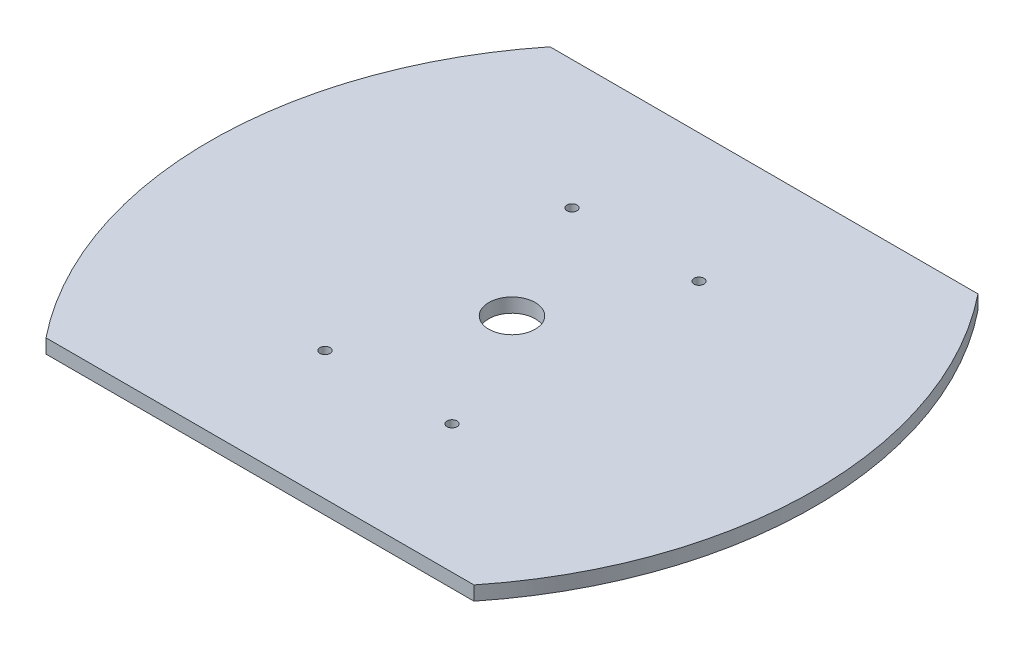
SolidWorks part; units mm, degrees
ref_plane "Front Plane" through (0, 0, 0) normal (0, 0, 1) x (1, 0, 0)
ref_plane "Top Plane" through (0, 0, 0) normal (0, 1, 0) x (1, 0, 0)
ref_plane "Right Plane" through (0, 0, 0) normal (1, 0, 0) x (0, 0, -1)
sketch "Sketch1" plane through (0, 0, 0) normal (0, 1, 0) x (1, 0, 0)
  line L1 (-106.1249, 125) -> (106.1249, 125)
  line L2 (-106.1249, 125) -> (-106.1249, -125) construction
  line L3 (-106.1249, -125) -> (106.1249, -125)
  line L4 (106.1249, 125) -> (106.1249, -125) construction
  line L5 (-106.1249, 125) -> (106.1249, -125) construction
  line L6 (-106.1249, -125) -> (106.1249, 125) construction
  arc A0 (-106.1249, -125) -> (-106.1249, 125) centre (50, 0) cw
  arc A1 (106.1249, 125) -> (106.1249, -125) centre (-50, 0) cw
  point P0 (0, 0)
  point P8 (-150, 0)
  point P9 (150, 0)
  dimension "D3" = 200
  dimension "D1" = 300
  dimension "D2" = 250
extrude "Boss-Extrude1" add sketch "Sketch1" along normal mid plane 7
sketch "Sketch2" plane through (0, 0, 0) normal (0, 1, 0) x (1, 0, 0)
  circle A0 centre (0, 0) radius 11.5
  dimension "D1" = 23
extrude "Cut-Extrude1" cut sketch "Sketch2" against normal mid plane 10
sketch "Sketch3" plane through (0, 3.5, 0) normal (0, 1, 0) x (1, 0, 0)
  line L1 (-31.5, 61.25) -> (31.5, 61.25) construction
  line L2 (-31.5, 61.25) -> (-31.5, -61.25) construction
  line L3 (-31.5, -61.25) -> (31.5, -61.25) construction
  line L4 (31.5, 61.25) -> (31.5, -61.25) construction
  line L5 (-31.5, 61.25) -> (31.5, -61.25) construction
  line L6 (-31.5, -61.25) -> (31.5, 61.25) construction
  circle A0 centre (-31.5, 61.25) radius 2.5
  circle A1 centre (31.5, 61.25) radius 2.5
  circle A2 centre (31.5, -61.25) radius 2.5
  circle A3 centre (-31.5, -61.25) radius 2.5
  point P0 (0, 0)
  dimension "D3" = 5
  dimension "D1" = 122.5
  dimension "D2" = 63
extrude "Cut-Extrude2" cut sketch "Sketch3" against normal blind 10
